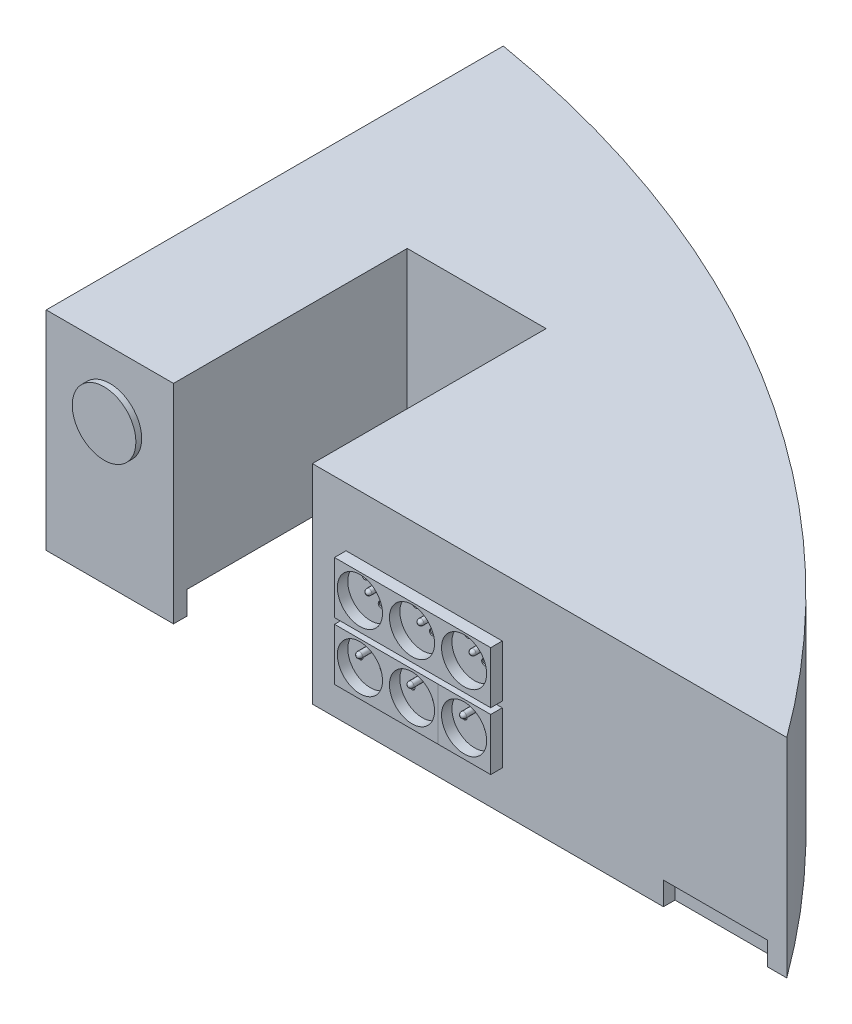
SolidWorks part; units mm, degrees
ref_plane "Plan de face" through (0, 0, 0) normal (0, 0, 1) x (1, 0, 0)
ref_plane "Plan de dessus" through (0, 0, 0) normal (0, 1, 0) x (1, 0, 0)
ref_plane "Plan de droite" through (0, 0, 0) normal (1, 0, 0) x (0, 0, -1)
sketch "Esquisse1" plane through (0, 0, 0) normal (0, 0, 1) x (1, 0, 0)
  line L0 (-73.406, 159.2736) -> (-73.406, -20.7264)
  line L1 (-73.406, -20.7264) -> (566.594, -20.7264)
  line L2 (566.594, -20.7264) -> (566.594, 159.2736)
  line L3 (566.594, 159.2736) -> (-73.406, 159.2736)
  dimension "D1" = 640
  dimension "D2" = 180
extrude "Extrusion1" add sketch "Esquisse1" along normal blind 395
sketch "Esquisse2" plane through (0, 0, 395) normal (0, 0, 1) x (1, 0, 0)
  line L0 (36.594, 159.2736) -> (36.594, -20.7264)
  line L1 (566.594, 159.2736) -> (-73.406, 159.2736) construction
  line L2 (-73.406, -20.7264) -> (566.594, -20.7264) construction
  line L3 (36.594, -20.7264) -> (156.594, -20.7264)
  line L4 (156.594, -20.7264) -> (156.594, 159.2736)
  line L5 (156.594, 159.2736) -> (36.594, 159.2736)
  line L6 (-73.406, 159.2736) -> (-73.406, -20.7264) construction
  line L7 (566.594, -20.7264) -> (566.594, 159.2736) construction
  dimension "D1" = 110
  dimension "D2" = 410
extrude "Enlèv. mat.-Extru.1" cut sketch "Esquisse2" against normal blind 202
sketch "Esquisse3" plane through (0, 159.2736, 0) normal (0, 1, 0) x (1, 0, 0)
  arc A0 (566.594, -395) -> (-73.406, 0) centre (-240.0671, -986.0142) ccw
  dimension "D1" = 1000
extrude "Enlèv. mat.-Extru.2" cut sketch "Esquisse3" against normal through all and the other way through all flip side to cut
sketch "Esquisse5" plane through (0, 159.2736, 0) normal (0, 1, 0) x (1, 0, 0)
  line L7 (156.594, -395) -> (566.594, -395)
  line L9 (-73.406, 0) -> (-73.406, -395)
  line L10 (-73.406, -395) -> (36.594, -395)
  line L11 (36.594, -395) -> (36.594, -193)
  line L12 (36.594, -193) -> (156.594, -193)
  line L13 (156.594, -193) -> (156.594, -395)
  arc A2 (566.594, -395) -> (-73.406, 0) centre (-240.0671, -986.0142) ccw
  arc A3 (566.594, -395) -> (-73.406, 0) centre (-240.0671, -986.0142) ccw
  dimension "D1" = 0
sketch "Esquisse12" plane through (0, 0, 395) normal (0, 0, 1) x (1, 0, 0)
  line L0 (320.7172, 108.5613) -> (320.7172, 63.5613)
  line L1 (185.7172, 13.5613) -> (320.7172, 13.5613)
  line L2 (185.7172, 63.5613) -> (185.7172, 108.5613)
  line L3 (320.7172, 108.5613) -> (185.7172, 108.5613)
  line L4 (320.7172, 63.5613) -> (185.7172, 63.5613)
  line L5 (320.7172, 58.5613) -> (185.7172, 58.5613)
  line L6 (320.7172, 58.5613) -> (320.7172, 13.5613)
  line L7 (185.7172, 13.5613) -> (185.7172, 58.5613)
  line L8 (185.7172, 58.5613) -> (185.8623, 58.1554)
  line L9 (275.7172, 108.5613) -> (275.7172, 63.5613)
  line L10 (230.7172, 63.5613) -> (230.7172, 108.5613)
  line L11 (275.7172, 58.5613) -> (275.7172, 13.5613)
  line L12 (230.7172, 58.5613) -> (230.7172, 13.5613)
  dimension "D1" = 135
  dimension "D2" = 95
  dimension "D3" = 45
  dimension "D4" = 45
  dimension "D5" = 45
  dimension "D6" = 45
extrude "Extrusion2" add sketch "Esquisse12" along normal blind 10
sketch "Esquisse13" plane through (0, 0, 405) normal (0, 0, 1) x (1, 0, 0)
  line L0 (320.7172, 63.5613) -> (320.7172, 108.5613) construction
  line L1 (320.7172, 13.5613) -> (320.7172, 58.5613) construction
  circle A0 centre (297.7172, 87.3459) radius 19.5
  circle A1 centre (252.7172, 87.3459) radius 19.5
  circle A2 centre (207.7172, 87.3459) radius 19.5
  circle A3 centre (207.7172, 37.0577) radius 19.5
  circle A4 centre (252.7172, 37.0577) radius 19.5
  circle A5 centre (297.7172, 37.0577) radius 19.5
  dimension "D1" = 39
  dimension "D2" = 23
  dimension "D3" = 23
  dimension "D4" = 45
  dimension "D5" = 45
  dimension "D6" = 45
  dimension "D7" = 45
extrude "Enlèv. mat.-Extru.3" cut sketch "Esquisse13" against normal blind 9
sketch "Esquisse14" plane through (0, 0, 405) normal (0, 0, 1) x (1, 0, 0)
  line L0 (274.9632, 58.5613) -> (274.9632, 13.5613)
  line L1 (185.7172, 58.5613) -> (320.7172, 58.5613) construction
  line L2 (320.7172, 13.5613) -> (185.7172, 13.5613) construction
  line L3 (274.9632, 58.5613) -> (320.7172, 58.5613)
  line L4 (320.7172, 58.5613) -> (320.7172, 13.5613)
  line L5 (320.7172, 13.5613) -> (320.7172, 58.5613) construction
  line L6 (320.7172, 13.5613) -> (274.9632, 13.5613)
  circle A0 centre (297.7172, 37.0577) radius 19.5
extrude "Extrusion6" add sketch "Esquisse14" along normal blind 0.0002
sketch "Esquisse15" plane through (0, 0, 396) normal (0, 0, 1) x (1, 0, 0)
  line L0 (320.7172, 13.5613) -> (320.7172, 58.5613) construction
  circle A0 centre (198.7172, 36.5338) radius 2.5
  circle A1 centre (218.7172, 36.5338) radius 2.5
  circle A2 centre (243.7172, 36.5338) radius 2.5
  circle A3 centre (263.7172, 36.5338) radius 2.5
  circle A4 centre (288.7172, 36.5338) radius 2.5
  circle A5 centre (308.7172, 36.5338) radius 2.5
  point P14 (320.7172, 36.0613)
  dimension "D1" = 5
  dimension "D2" = 12
  dimension "D3" = 20
  dimension "D4" = 25
  dimension "D5" = 20
  dimension "D6" = 25
  dimension "D7" = 20
extrude "Enlèv. mat.-Extru.5" cut sketch "Esquisse15" against normal blind 1
sketch "Esquisse16" plane through (0, 0, 396) normal (0, 0, 1) x (1, 0, 0)
  circle A0 centre (297.7741, 47.0479) radius 2.5
  circle A1 centre (252.3339, 47.0479) radius 2.5
  circle A2 centre (207.9159, 47.0479) radius 2.5
  dimension "D1" = 5
extrude "Extrusion7" add sketch "Esquisse16" along normal blind 12
fillet "Congé1" radius 2.5 3 edges at (210.4159, 47.0479, 408) (300.2741, 47.0479, 408) (254.8339, 47.0479, 408)
sketch "Esquisse17" plane through (0, 0, 396) normal (0, 0, 1) x (1, 0, 0)
  circle A0 centre (203.0261, 98.5412) radius 2.5
  circle A1 centre (217.0326, 84.2647) radius 2.5
  circle A2 centre (246.5045, 99.2141) radius 2.5
  circle A3 centre (261.2687, 85.7227) radius 2.5
  circle A4 centre (291.5045, 99.2141) radius 2.5
  circle A5 centre (306.4434, 85.9222) radius 2.5
  dimension "D1" = 5
  dimension "D3" = 20
  dimension "D4" = 43.4784
  dimension "D5" = 20
  dimension "D6" = 45
  dimension "D7" = 19.9962
extrude "Enlèv. mat.-Extru.6" cut sketch "Esquisse17" against normal blind 1
sketch "Esquisse18" plane through (0, 0, 396) normal (0, 0, 1) x (1, 0, 0)
  line L0 (207.7172, 87.3459) -> (219.5326, 102.8587) construction
  line L1 (252.7172, 87.3459) -> (264.5326, 102.8587) construction
  line L2 (297.7172, 87.3459) -> (309.5326, 102.8587) construction
  circle A0 centre (207.7172, 87.3459) radius 19.5 construction
  circle A1 centre (252.7172, 87.3459) radius 19.5 construction
  circle A2 centre (297.7172, 87.3459) radius 19.5 construction
  circle A3 centre (305.9882, 98.2052) radius 2.5
  circle A4 centre (260.9882, 98.2052) radius 2.5
  circle A5 centre (215.9882, 98.2052) radius 2.5
  dimension "D1" = 5
  dimension "D2" = 5
  dimension "D3" = 5
extrude "Extrusion8" add sketch "Esquisse18" along normal blind 12
fillet "Congé2" radius 2.5 3 edges at (308.4882, 98.2052, 408) (263.4882, 98.2052, 408) (218.4882, 98.2052, 408)
sketch "Esquisse19" plane through (0, 0, 395) normal (0, 0, 1) x (1, 0, 0)
  line L0 (36.594, 159.2736) -> (-73.406, 159.2736) construction
  line L1 (36.594, 159.2736) -> (36.594, -20.7264) construction
  circle A0 centre (-18.406, 104.2736) radius 27.5
  point P2 (-18.406, 159.2736)
  dimension "D1" = 55
  dimension "D2" = 55
  dimension "D3" = 55
extrude "Extrusion9" add sketch "Esquisse19" along normal blind 5
sketch "Esquisse21" plane through (0, 0, 395) normal (0, 0, 1) x (1, 0, 0)
  line L0 (156.594, -20.7264) -> (566.594, -20.7264) construction
  line L1 (460, -20.7264) -> (550, -20.7264)
  line L2 (460, -20.7264) -> (460, -0.7264)
  line L3 (460, -0.7264) -> (550, -0.7264)
  line L4 (550, -20.7264) -> (550, -0.7264)
  dimension "D1" = 90
  dimension "D2" = 20
  dimension "D3" = 460
sketch "Esquisse22" plane through (0, -20.7264, 0) normal (0, -1, 0) x (1, 0, 0)
  line L0 (-73.406, 383.5017) -> (542.9973, 383.5017)
  line L1 (-73.406, 395) -> (-73.406, 0) construction
  line L2 (-63.1876, 383.5017) -> (-63.1876, 13.9417)
  arc A1 (-63.1876, 13.9417) -> (542.9973, 383.5017) centre (-240.0671, 986.0142) ccw
  dimension "D1" = 602.5125
  dimension "D2" = 369.5599
  dimension "D3" = 176.8795
extrude "Enlèv. mat.-Extru.9" cut sketch "Esquisse22" against normal blind 20
extrude "Enlèv. mat.-Extru.8" cut sketch "Esquisse21" against normal blind 10
